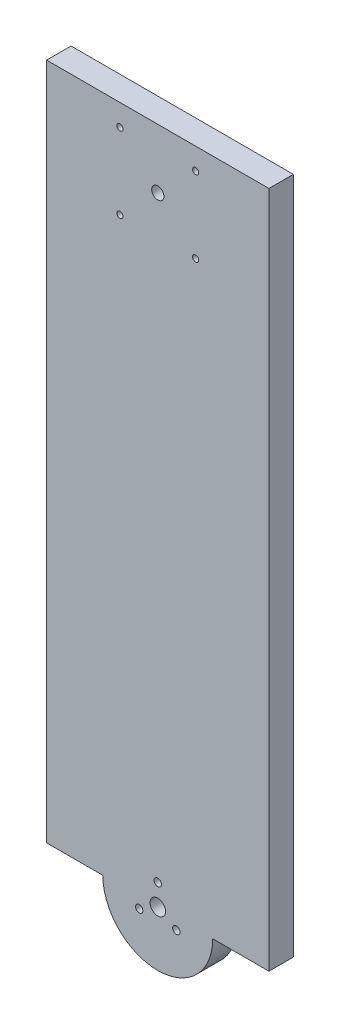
SolidWorks part; units mm, degrees
ref_plane "Front Plane" through (0, 0, 0) normal (0, 0, 1) x (1, 0, 0)
ref_plane "Top Plane" through (0, 0, 0) normal (0, 1, 0) x (1, 0, 0)
ref_plane "Right Plane" through (0, 0, 0) normal (1, 0, 0) x (0, 0, -1)
sketch "Sketch1" plane through (0, 0, 0) normal (0, 0, 1) x (1, 0, 0)
  line L0 (0, -1565.9861) -> (0, 76733.3209) construction
  line L1 (-22.5, 130) -> (22.5, 130)
  line L2 (-22.5, 130) -> (-22.5, -147.5)
  line L4 (22.5, 130) -> (22.5, -147.5)
  line L5 (-22.5, 130) -> (29.4093, -169.9204) construction
  line L6 (-22.5, -130) -> (22.5, 130) construction
  line L7 (-1565.9861, 0) -> (76733.3209, 0) construction
  line L8 (-42.7696, 105.6639) -> (42.7696, 105.6639) construction
  line L9 (-21.1, 126.7639) -> (21.1, 126.7639) construction
  line L10 (-21.1, 126.7639) -> (-21.1, 84.5639) construction
  line L11 (-21.1, 84.5639) -> (21.1, 84.5639) construction
  line L12 (21.1, 126.7639) -> (21.1, 84.5639) construction
  line L13 (-21.1, 126.7639) -> (21.1, 84.5639) construction
  line L14 (-21.1, 84.5639) -> (21.1, 126.7639) construction
  circle A0 centre (-15.5, 121.1639) radius 1.25
  circle A1 centre (15.5, 121.1639) radius 1.25
  circle A2 centre (15.5, 90.1639) radius 1.25
  circle A3 centre (-15.5, 90.1639) radius 1.25
  circle A4 centre (0, 105.6639) radius 2.5
  circle A5 centre (0, -147.5) radius 8.75 construction
  arc A6 (-22.5, -147.5) -> (22.5, -147.5) centre (0, -147.5) ccw
  circle A7 centre (0, -138.75) radius 1.5
  circle A8 centre (7.5777, -151.875) radius 1.5
  circle A9 centre (-7.5777, -151.875) radius 1.5
  circle A10 centre (0, -147.5) radius 3.15
  point P0 (0, 0)
  point P9 (0, 105.6639)
  point P20 (0, 105.6639)
  point P28 (0, 83.0234)
  point P40 (0, -170)
  point P46 (0, -107.5)
  point P49 (0, -147.5)
  dimension "D4" = 2.5
  dimension "D6" = 5
  dimension "D9" = 17.5
  dimension "D10" = 3
  dimension "D12" = 6.3
  dimension "D1" = 45
  dimension "D2" = 300
  dimension "D3" = 42.2
  dimension "D5" = 31
  dimension "D11" = 3
extrude "Boss-Extrude1" add sketch "Sketch1" along normal blind 10
sketch "Sketch2" plane through (22.5, 0, 0) normal (1, 0, 0) x (0, 0, -1)
  line L1 (-10, 130) -> (0, 130)
  line L2 (-10, 130) -> (-10, -147.5)
  line L3 (-10, -147.5) -> (0, -147.5)
  line L4 (0, 130) -> (0, -147.5)
extrude "Boss-Extrude2" add sketch "Sketch2" along normal blind 23
sketch "Sketch3" plane through (-22.5, 0, 0) normal (-1, 0, 0) x (0, 0, 1)
  line L1 (0, 130) -> (10, 130)
  line L2 (0, 130) -> (0, -147.5)
  line L3 (0, -147.5) -> (10, -147.5)
  line L4 (10, 130) -> (10, -147.5)
extrude "Boss-Extrude3" add sketch "Sketch3" along normal blind 23
